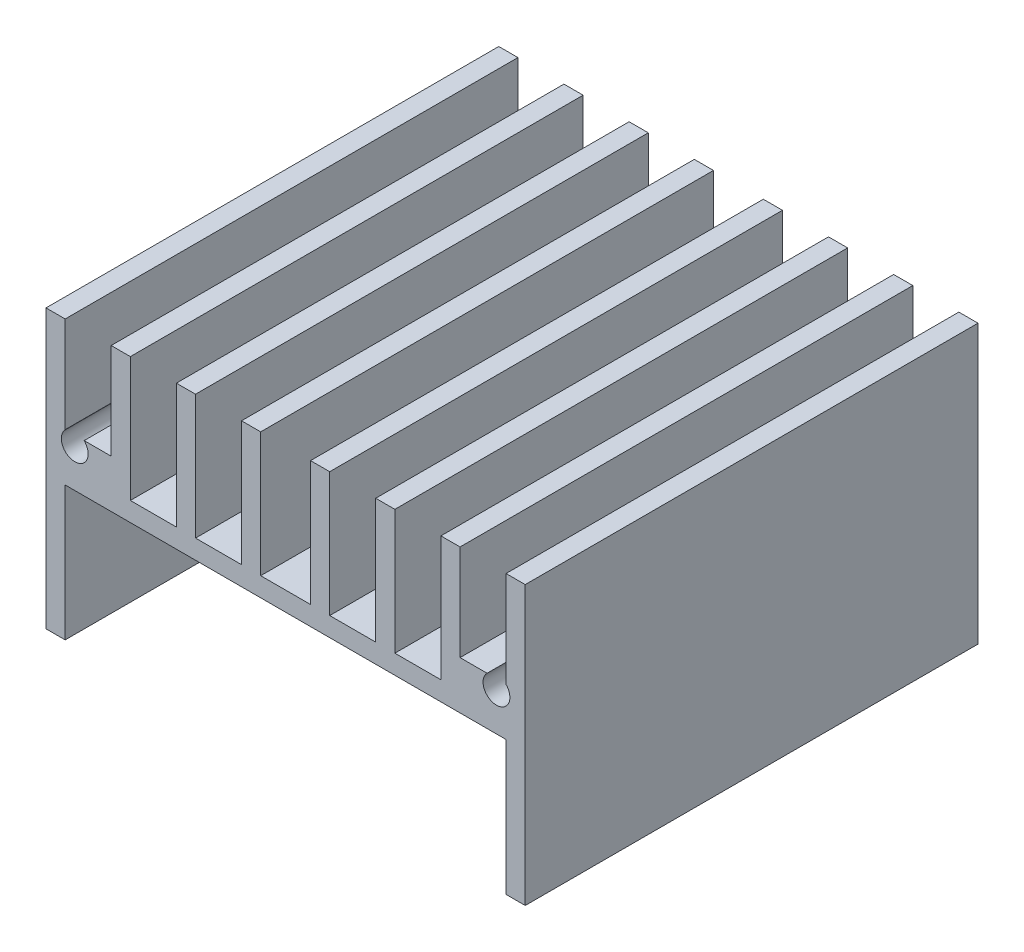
SolidWorks part; units mm, degrees
ref_plane "Спереди" through (0, 0, 0) normal (0, 0, 1) x (1, 0, 0)
ref_plane "Сверху" through (0, 0, 0) normal (0, 1, 0) x (1, 0, 0)
ref_plane "Справа" through (0, 0, 0) normal (1, 0, 0) x (0, 0, -1)
sketch "Эскиз1" plane through (0, 0, 0) normal (0, 0, 1) x (1, 0, 0)
  line L0 (-15.875, -11.43) -> (-15.875, 6.985)
  line L1 (-15.875, 6.985) -> (-14.605, 6.985)
  line L2 (-14.605, 6.985) -> (-14.605, -1.27)
  line L3 (-14.605, -1.27) -> (-11.557, -1.27)
  line L4 (-11.557, -1.27) -> (-11.557, 6.985)
  line L5 (-11.557, 6.985) -> (-10.287, 6.985)
  line L6 (-10.287, 6.985) -> (-10.287, -1.27)
  line L7 (-10.287, -1.27) -> (-7.239, -1.27)
  line L8 (-7.239, -1.27) -> (-7.239, 6.985)
  line L9 (-7.239, 6.985) -> (-5.969, 6.985)
  line L10 (-5.969, 6.985) -> (-5.969, -1.27)
  line L11 (-5.969, -1.27) -> (-2.921, -1.27)
  line L12 (-2.921, -1.27) -> (-2.921, 6.985)
  line L13 (-2.921, 6.985) -> (-1.651, 6.985)
  line L14 (-1.651, 6.985) -> (-1.651, -1.27)
  line L15 (-1.651, -1.27) -> (1.651, -1.27)
  line L16 (1.651, -1.27) -> (1.651, 6.985)
  line L17 (1.651, 6.985) -> (2.921, 6.985)
  line L18 (2.921, 6.985) -> (2.921, -1.27)
  line L19 (2.921, -1.27) -> (5.969, -1.27)
  line L20 (5.969, -1.27) -> (5.969, 6.985)
  line L21 (5.969, 6.985) -> (7.239, 6.985)
  line L22 (7.239, 6.985) -> (7.239, -1.27)
  line L23 (7.239, -1.27) -> (10.287, -1.27)
  line L24 (10.287, -1.27) -> (10.287, 6.985)
  line L25 (10.287, 6.985) -> (11.557, 6.985)
  line L26 (11.557, 6.985) -> (11.557, -1.27)
  line L27 (11.557, -1.27) -> (14.605, -1.27)
  line L28 (14.605, -1.27) -> (14.605, 6.985)
  line L29 (14.605, 6.985) -> (15.875, 6.985)
  line L30 (15.875, 6.985) -> (15.875, -11.43)
  line L31 (15.875, -11.43) -> (14.605, -11.43)
  line L32 (14.605, -11.43) -> (14.605, -2.54)
  line L33 (14.605, -2.54) -> (-14.605, -2.54)
  line L34 (-14.605, -2.54) -> (-14.605, -11.43)
  line L35 (-14.605, -11.43) -> (-15.875, -11.43)
extrude "Бобышка-Вытянуть1" add sketch "Эскиз1" along normal blind 29.9974
sketch "Эскиз3" plane through (0, -1.27, 0) normal (0, 1, 0) x (1, 0, 0)
  line L1 (-14.605, 0) -> (-11.557, 0)
  line L2 (-14.605, 0) -> (-14.605, -29.9974)
  line L3 (-14.605, -29.9974) -> (-11.557, -29.9974)
  line L4 (-11.557, 0) -> (-11.557, -29.9974)
  line L5 (11.557, 0) -> (14.605, 0)
  line L6 (11.557, 0) -> (11.557, -29.9974)
  line L7 (11.557, -29.9974) -> (14.605, -29.9974)
  line L8 (14.605, 0) -> (14.605, -29.9974)
extrude "Бобышка-Вытянуть3" add sketch "Эскиз3" along normal blind 1.905
sketch "Эскиз4" plane through (0, 0, 0) normal (0, 0, -1) x (-1, 0, 0)
  circle A0 centre (13.97, 0) radius 0.889
  circle A1 centre (-13.97, 0) radius 0.889
sketch "Эскиз5" plane through (0, -2.54, 0) normal (0, -1, 0) x (1, 0, 0)
  circle A0 centre (-8.89, 19.9898) radius 1.4986
  circle A1 centre (8.89, 19.9898) radius 1.4986
extrude "Вырез-Вытянуть1" cut sketch "Эскиз5" against normal up to surface (1.27 mm away)
extrude "Cut-Extrude1" cut sketch "Эскиз4" against normal up to surface (29.9974 mm away)
